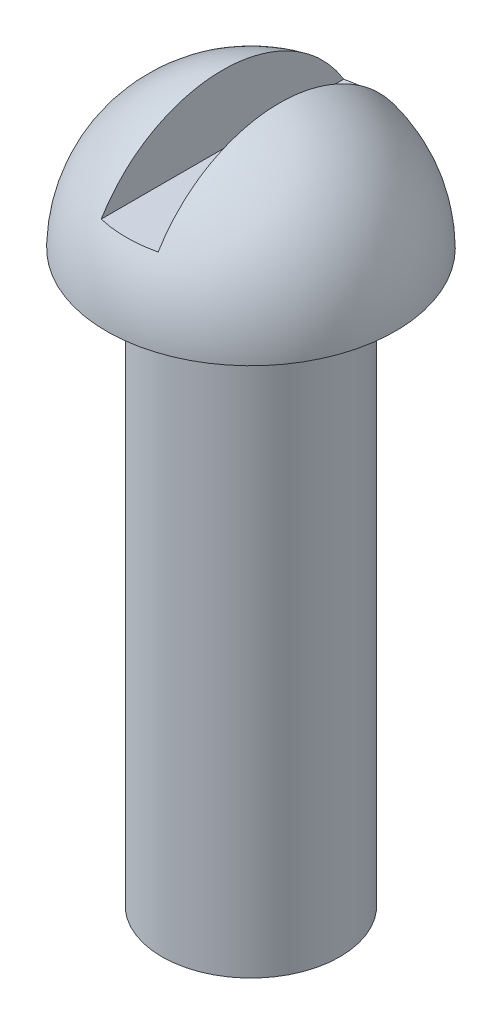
SolidWorks part; units mm, degrees
ref_plane "Front" through (0, 0, 0) normal (0, 0, 1) x (1, 0, 0)
ref_plane "Top" through (0, 0, 0) normal (0, 1, 0) x (1, 0, 0)
ref_plane "Right" through (0, 0, 0) normal (1, 0, 0) x (0, 0, -1)
sketch "Sketch1" plane through (0, 0, 0) normal (0, 0, 1) x (1, 0, 0)
  line L0 (0, 10.1105) -> (0, -20.32) construction
  line L1 (5.1562, 0) -> (3.175, 0)
  line L2 (3.175, 0) -> (3.175, -20.32)
  line L3 (3.175, -20.32) -> (0, -20.32)
  line L4 (0, -20.32) -> (0, 5.08)
  line L5 (0, 5.08) -> (-4.8734, 5.08) construction
  line L6 (5.6718, 0) -> (-5.6718, 0) construction
  arc A0 (0, 5.08) -> (5.1562, 0) centre (0, -0.0768) cw
  dimension "D1" = 10.3124
  dimension "D2" = 6.35
  dimension "D3" = 25.4
  dimension "D4" = 5.08
revolve "Base-Revolve" add sketch "Sketch1" angle 360 about L0
sketch "Sketch2" plane through (0, 0, 0) normal (0, 0, 1) x (1, 0, 0)
  line L1 (-1.016, 4.9789) -> (-1.016, 2.54)
  line L2 (1.016, 2.54) -> (-1.016, 2.54)
  line L3 (1.016, 2.54) -> (1.016, 4.9789)
  line L5 (0, 2.9275) -> (0, -3.9159) construction
  line L6 (0, -20.32) -> (0, 0) construction
  arc A0 (5.1562, 0) -> (-5.1562, 0) centre (0, -0.0768) ccw construction
  arc A4 (1.016, 4.9789) -> (-1.016, 4.9789) centre (0, -0.0768) ccw
  dimension "D1" = 2.032
  dimension "D2" = 2.54
extrude "Cut-Extrude1" cut sketch "Sketch2" against normal through all and the other way through all
